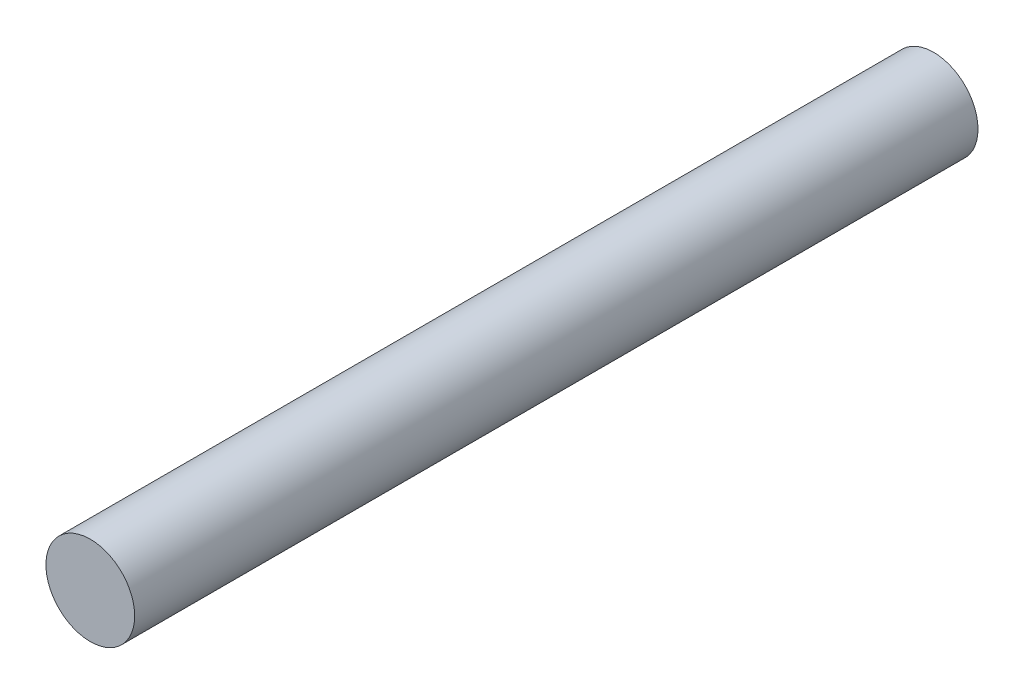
SolidWorks part; units mm, degrees
ref_plane "Face" through (0, 0, 0) normal (0, 0, 1) x (1, 0, 0)
ref_plane "Dessus" through (0, 0, 0) normal (0, 1, 0) x (1, 0, 0)
ref_plane "Droite" through (0, 0, 0) normal (1, 0, 0) x (0, 0, -1)
sketch "Esquisse1" plane through (0, 0, 0) normal (0, 0, 1) x (1, 0, 0)
  circle A0 centre (0, 0) radius 1
  dimension "D1" = 2
extrude "Extrusion1" add sketch "Esquisse1" along normal blind 19
